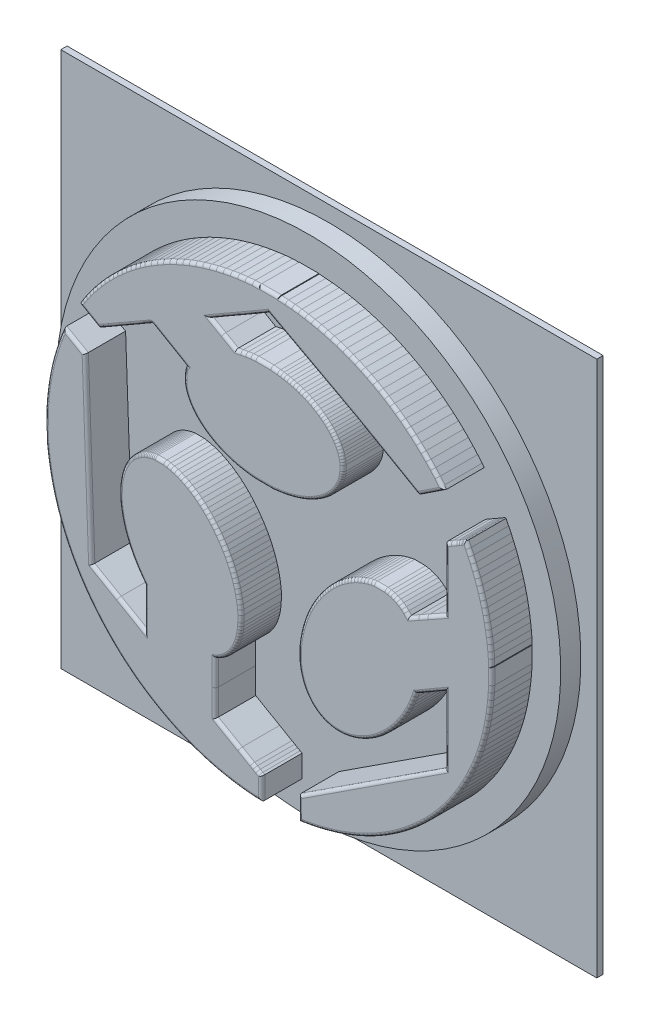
SolidWorks part; units mm, degrees
ref_plane "Спереди" through (0, 0, 0) normal (0, 0, 1) x (1, 0, 0)
ref_plane "Сверху" through (0, 0, 0) normal (0, 1, 0) x (1, 0, 0)
ref_plane "Справа" through (0, 0, 0) normal (1, 0, 0) x (0, 0, -1)
sketch "Эскиз3" plane through (0, 0, 0) normal (0, 0, 1) x (1, 0, 0)
  line L0 (2.1275, 44.2006) -> (2.0563, 44.2718)
  line L1 (2.0563, 44.2718) -> (-1.8596, 44.2718)
  line L2 (-1.8596, 44.2718) -> (-1.9308, 44.2006)
  line L3 (-1.9308, 44.2006) -> (-3.1411, 44.2006)
  line L4 (-3.1411, 44.2006) -> (-4.6219, 44.0589)
  line L5 (-4.6219, 44.0589) -> (-6.0838, 43.8731)
  line L6 (-6.0838, 43.8731) -> (-7.527, 43.6433)
  line L7 (-7.527, 43.6433) -> (-8.9515, 43.3697)
  line L8 (-8.9515, 43.3697) -> (-10.3575, 43.0524)
  line L9 (-10.3575, 43.0524) -> (-11.7451, 42.6915)
  line L10 (-11.7451, 42.6915) -> (-13.1145, 42.2873)
  line L11 (-13.1145, 42.2873) -> (-14.4658, 41.8398)
  line L12 (-14.4658, 41.8398) -> (-15.7992, 41.3493)
  line L13 (-15.7992, 41.3493) -> (-17.1147, 40.8158)
  line L14 (-17.1147, 40.8158) -> (-18.4125, 40.2395)
  line L15 (-18.4125, 40.2395) -> (-19.6927, 39.6206)
  line L16 (-19.6927, 39.6206) -> (-20.9555, 38.9592)
  line L17 (-20.9555, 38.9592) -> (-22.201, 38.2555)
  line L18 (-22.201, 38.2555) -> (-23.4294, 37.5096)
  line L19 (-23.4294, 37.5096) -> (-24.6407, 36.7216)
  line L20 (-24.6407, 36.7216) -> (-25.584, 36.0682)
  line L21 (-25.584, 36.0682) -> (-26.5149, 35.385)
  line L22 (-26.5149, 35.385) -> (-27.4331, 34.6721)
  line L23 (-27.4331, 34.6721) -> (-28.3385, 33.9297)
  line L24 (-28.3385, 33.9297) -> (-29.2308, 33.1578)
  line L25 (-29.2308, 33.1578) -> (-30.1099, 32.3566)
  line L26 (-30.1099, 32.3566) -> (-30.9755, 31.5263)
  line L27 (-30.9755, 31.5263) -> (-31.8274, 30.6668)
  line L28 (-31.8274, 30.6668) -> (-32.6621, 29.7768)
  line L29 (-32.6621, 29.7768) -> (-33.4569, 28.8777)
  line L30 (-33.4569, 28.8777) -> (-34.2198, 27.9653)
  line L31 (-34.2198, 27.9653) -> (-34.9586, 27.0358)
  line L32 (-34.9586, 27.0358) -> (-35.6246, 26.159)
  line L33 (-35.6246, 26.159) -> (-36.2577, 25.2685)
  line L34 (-36.2577, 25.2685) -> (-36.9008, 24.3223)
  line L35 (-36.9008, 24.3223) -> (-37.2006, 23.8353)
  line L36 (-37.2006, 23.8353) -> (-37.4701, 23.3218)
  line L37 (-37.4701, 23.3218) -> (-36.9719, 23.011)
  line L38 (-36.9719, 23.011) -> (-36.4982, 22.7359)
  line L39 (-36.4982, 22.7359) -> (-35.5449, 22.1859)
  line L40 (-35.5449, 22.1859) -> (-34.579, 21.6358)
  line L41 (-34.579, 21.6358) -> (-34.0955, 21.3511)
  line L42 (-34.0955, 21.3511) -> (-33.5906, 21.0158)
  line L43 (-33.5906, 21.0158) -> (-32.5015, 21.5978)
  line L44 (-32.5015, 21.5978) -> (-31.4203, 22.2157)
  line L45 (-31.4203, 22.2157) -> (-29.2647, 23.4714)
  line L46 (-29.2647, 23.4714) -> (-27.136, 24.6973)
  line L47 (-27.136, 24.6973) -> (-25.0078, 25.9187)
  line L48 (-25.0078, 25.9187) -> (-24.5071, 26.2214)
  line L49 (-24.5071, 26.2214) -> (-24.2561, 26.3658)
  line L50 (-24.2561, 26.3658) -> (-24.0067, 26.484)
  line L51 (-24.0067, 26.484) -> (-23.8674, 26.5559)
  line L52 (-23.8674, 26.5559) -> (-23.7263, 26.6515)
  line L53 (-23.7263, 26.6515) -> (-23.4407, 26.8593)
  line L54 (-23.4407, 26.8593) -> (-23.2971, 26.9444)
  line L55 (-23.2971, 26.9444) -> (-23.1535, 26.9989)
  line L56 (-23.1535, 26.9989) -> (-23.0104, 27.0091)
  line L57 (-23.0104, 27.0091) -> (-22.8682, 26.9615)
  line L58 (-22.8682, 26.9615) -> (-20.6586, 25.6844)
  line L59 (-20.6586, 25.6844) -> (-18.5187, 24.4469)
  line L60 (-18.5187, 24.4469) -> (-16.3858, 23.1997)
  line L61 (-16.3858, 23.1997) -> (-16.4317, 23.1505)
  line L62 (-16.4317, 23.1505) -> (-16.4612, 23.0925)
  line L63 (-16.4612, 23.0925) -> (-16.4888, 22.9607)
  line L64 (-16.4888, 22.9607) -> (-16.5042, 22.8258)
  line L65 (-16.5042, 22.8258) -> (-16.5431, 22.7093)
  line L66 (-16.5431, 22.7093) -> (-16.5868, 22.613)
  line L67 (-16.5868, 22.613) -> (-16.611, 22.5049)
  line L68 (-16.611, 22.5049) -> (-16.6285, 22.2702)
  line L69 (-16.6285, 22.2702) -> (-16.6509, 22.0375)
  line L70 (-16.6509, 22.0375) -> (-16.6811, 21.9321)
  line L71 (-16.6811, 21.9321) -> (-16.7332, 21.8394)
  line L72 (-16.7332, 21.8394) -> (-16.7399, 20.1358)
  line L73 (-16.7399, 20.1358) -> (-16.6698, 19.6483)
  line L74 (-16.6698, 19.6483) -> (-16.5605, 19.1654)
  line L75 (-16.5605, 19.1654) -> (-16.4145, 18.6884)
  line L76 (-16.4145, 18.6884) -> (-16.2339, 18.2184)
  line L77 (-16.2339, 18.2184) -> (-16.021, 17.7567)
  line L78 (-16.021, 17.7567) -> (-15.7781, 17.3044)
  line L79 (-15.7781, 17.3044) -> (-15.5075, 16.8628)
  line L80 (-15.5075, 16.8628) -> (-15.2113, 16.433)
  line L81 (-15.2113, 16.433) -> (-14.8919, 16.0164)
  line L82 (-14.8919, 16.0164) -> (-14.5516, 15.614)
  line L83 (-14.5516, 15.614) -> (-14.1925, 15.2271)
  line L84 (-14.1925, 15.2271) -> (-13.817, 14.8568)
  line L85 (-13.817, 14.8568) -> (-13.4272, 14.5045)
  line L86 (-13.4272, 14.5045) -> (-13.0256, 14.1713)
  line L87 (-13.0256, 14.1713) -> (-12.6143, 13.8584)
  line L88 (-12.6143, 13.8584) -> (-12.1956, 13.567)
  line L89 (-12.1956, 13.567) -> (-11.6655, 13.2283)
  line L90 (-11.6655, 13.2283) -> (-11.1267, 12.9109)
  line L91 (-11.1267, 12.9109) -> (-10.5794, 12.6145)
  line L92 (-10.5794, 12.6145) -> (-10.0235, 12.3386)
  line L93 (-10.0235, 12.3386) -> (-9.4592, 12.0828)
  line L94 (-9.4592, 12.0828) -> (-8.8865, 11.8467)
  line L95 (-8.8865, 11.8467) -> (-8.3055, 11.6299)
  line L96 (-8.3055, 11.6299) -> (-7.7162, 11.432)
  line L97 (-7.7162, 11.432) -> (-7.1187, 11.2526)
  line L98 (-7.1187, 11.2526) -> (-6.513, 11.0914)
  line L99 (-6.513, 11.0914) -> (-5.8993, 10.9478)
  line L100 (-5.8993, 10.9478) -> (-5.2776, 10.8215)
  line L101 (-5.2776, 10.8215) -> (-4.6479, 10.7121)
  line L102 (-4.6479, 10.7121) -> (-4.0103, 10.6191)
  line L103 (-4.0103, 10.6191) -> (-2.7117, 10.4811)
  line L104 (-2.7117, 10.4811) -> (0.8459, 10.4529)
  line L105 (0.8459, 10.4529) -> (2.1472, 10.6082)
  line L106 (2.1472, 10.6082) -> (3.4187, 10.8214)
  line L107 (3.4187, 10.8214) -> (4.0431, 10.9516)
  line L108 (4.0431, 10.9516) -> (4.6599, 11.0984)
  line L109 (4.6599, 11.0984) -> (5.2691, 11.2625)
  line L110 (5.2691, 11.2625) -> (5.8706, 11.4448)
  line L111 (5.8706, 11.4448) -> (6.4643, 11.6458)
  line L112 (6.4643, 11.6458) -> (7.0501, 11.8663)
  line L113 (7.0501, 11.8663) -> (7.6281, 12.1071)
  line L114 (7.6281, 12.1071) -> (8.1982, 12.3688)
  line L115 (8.1982, 12.3688) -> (8.7603, 12.6522)
  line L116 (8.7603, 12.6522) -> (9.3144, 12.958)
  line L117 (9.3144, 12.958) -> (9.8604, 13.2869)
  line L118 (9.8604, 13.2869) -> (10.3982, 13.6396)
  line L119 (10.3982, 13.6396) -> (10.8274, 13.9463)
  line L120 (10.8274, 13.9463) -> (11.246, 14.2728)
  line L121 (11.246, 14.2728) -> (11.6518, 14.6181)
  line L122 (11.6518, 14.6181) -> (12.0428, 14.9815)
  line L123 (12.0428, 14.9815) -> (12.417, 15.3619)
  line L124 (12.417, 15.3619) -> (12.7722, 15.7586)
  line L125 (12.7722, 15.7586) -> (13.1065, 16.1706)
  line L126 (13.1065, 16.1706) -> (13.4177, 16.597)
  line L127 (13.4177, 16.597) -> (13.7039, 17.0371)
  line L128 (13.7039, 17.0371) -> (13.9628, 17.4898)
  line L129 (13.9628, 17.4898) -> (14.1926, 17.9543)
  line L130 (14.1926, 17.9543) -> (14.391, 18.4297)
  line L131 (14.391, 18.4297) -> (14.5561, 18.9152)
  line L132 (14.5561, 18.9152) -> (14.6858, 19.4099)
  line L133 (14.6858, 19.4099) -> (14.778, 19.9128)
  line L134 (14.778, 19.9128) -> (14.8307, 20.4231)
  line L135 (14.8307, 20.4231) -> (14.8719, 21.5597)
  line L136 (14.8719, 21.5597) -> (14.8162, 22.063)
  line L137 (14.8162, 22.063) -> (14.7203, 22.5604)
  line L138 (14.7203, 22.5604) -> (14.5865, 23.051)
  line L139 (14.5865, 23.051) -> (14.417, 23.5336)
  line L140 (14.417, 23.5336) -> (14.2138, 24.0073)
  line L141 (14.2138, 24.0073) -> (13.9793, 24.471)
  line L142 (13.9793, 24.471) -> (13.7155, 24.9237)
  line L143 (13.7155, 24.9237) -> (13.4247, 25.3642)
  line L144 (13.4247, 25.3642) -> (13.1092, 25.7916)
  line L145 (13.1092, 25.7916) -> (12.771, 26.2048)
  line L146 (12.771, 26.2048) -> (12.4123, 26.6028)
  line L147 (12.4123, 26.6028) -> (12.0354, 26.9845)
  line L148 (12.0354, 26.9845) -> (11.6424, 27.3488)
  line L149 (11.6424, 27.3488) -> (11.2356, 27.6948)
  line L150 (11.2356, 27.6948) -> (10.8171, 28.0213)
  line L151 (10.8171, 28.0213) -> (10.3891, 28.3274)
  line L152 (10.3891, 28.3274) -> (9.8373, 28.689)
  line L153 (9.8373, 28.689) -> (9.2769, 29.0256)
  line L154 (9.2769, 29.0256) -> (8.7081, 29.3378)
  line L155 (8.7081, 29.3378) -> (8.1308, 29.6264)
  line L156 (8.1308, 29.6264) -> (7.545, 29.8921)
  line L157 (7.545, 29.8921) -> (6.9509, 30.1356)
  line L158 (6.9509, 30.1356) -> (6.3485, 30.3576)
  line L159 (6.3485, 30.3576) -> (5.7378, 30.5588)
  line L160 (5.7378, 30.5588) -> (5.1188, 30.74)
  line L161 (5.1188, 30.74) -> (4.4917, 30.9018)
  line L162 (4.4917, 30.9018) -> (3.8564, 31.0451)
  line L163 (3.8564, 31.0451) -> (3.2131, 31.1704)
  line L164 (3.2131, 31.1704) -> (2.5616, 31.2786)
  line L165 (2.5616, 31.2786) -> (1.9022, 31.3703)
  line L166 (1.9022, 31.3703) -> (0.5595, 31.5073)
  line L167 (0.5595, 31.5073) -> (-2.4292, 31.5274)
  line L168 (-2.4292, 31.5274) -> (-3.4693, 31.4304)
  line L169 (-3.4693, 31.4304) -> (-4.492, 31.2864)
  line L170 (-4.492, 31.2864) -> (-5.4976, 31.103)
  line L171 (-5.4976, 31.103) -> (-6.4867, 30.8878)
  line L172 (-6.4867, 30.8878) -> (-8.9777, 32.3147)
  line L173 (-8.9777, 32.3147) -> (-11.4696, 33.7318)
  line L174 (-11.4696, 33.7318) -> (-8.601, 35.4001)
  line L175 (-8.601, 35.4001) -> (-5.7396, 37.0419)
  line L176 (-5.7396, 37.0419) -> (-2.8709, 38.6969)
  line L177 (-2.8709, 38.6969) -> (0.0195, 40.4045)
  line L178 (0.0195, 40.4045) -> (17.4904, 31.0451)
  line L179 (17.4904, 31.0451) -> (29.7987, 24.0073)
  line L180 (6.0294, -39.2566) -> (6.0294, -43.883)
  line L181 (-2.1531, -39.2566) -> (-1.6503, -39.5238)
  line L182 (-1.2539, -39.7292) -> (-1.29, -44.1558)
  line L189 (34.8335, 27.3338) -> (34.4085, 27.8744)
  line L190 (34.4085, 27.8744) -> (33.5296, 28.9242)
  line L191 (33.5296, 28.9242) -> (32.6229, 29.9426)
  line L192 (32.6229, 29.9426) -> (31.6891, 30.9292)
  line L193 (31.6891, 30.9292) -> (30.7292, 31.8835)
  line L194 (30.7292, 31.8835) -> (29.744, 32.8053)
  line L195 (29.744, 32.8053) -> (28.7345, 33.6942)
  line L196 (28.7345, 33.6942) -> (27.7014, 34.5497)
  line L197 (27.7014, 34.5497) -> (26.6457, 35.3717)
  line L198 (26.6457, 35.3717) -> (25.5682, 36.1596)
  line L199 (25.5682, 36.1596) -> (24.4699, 36.9133)
  line L200 (24.4699, 36.9133) -> (23.3516, 37.6322)
  line L201 (23.3516, 37.6322) -> (22.2141, 38.316)
  line L202 (22.2141, 38.316) -> (21.0583, 38.9645)
  line L203 (21.0583, 38.9645) -> (19.8852, 39.5772)
  line L204 (19.8852, 39.5772) -> (18.6956, 40.1538)
  line L205 (18.6956, 40.1538) -> (17.4904, 40.6939)
  line L206 (17.4904, 40.6939) -> (16.2704, 41.1971)
  line L207 (16.2704, 41.1971) -> (15.0365, 41.6632)
  line L208 (15.0365, 41.6632) -> (13.7896, 42.0918)
  line L209 (13.7896, 42.0918) -> (12.5307, 42.4824)
  line L210 (12.5307, 42.4824) -> (11.2604, 42.8348)
  line L211 (11.2604, 42.8348) -> (9.9798, 43.1486)
  line L212 (9.9798, 43.1486) -> (8.6897, 43.4234)
  line L213 (8.6897, 43.4234) -> (7.391, 43.6589)
  line L214 (7.391, 43.6589) -> (6.0845, 43.8547)
  line L215 (6.0845, 43.8547) -> (4.7712, 44.0105)
  line L216 (4.7712, 44.0105) -> (3.4519, 44.1259)
  line L217 (3.4519, 44.1259) -> (2.1275, 44.2006)
  line L218 (34.8335, 27.3338) -> (29.7987, 24.0073)
  line L227 (-40.5204, 17.6546) -> (-40.7542, 17.1411)
  line L228 (-40.7542, 17.1411) -> (-41.1098, 16.2822)
  line L229 (-41.1098, 16.2822) -> (-41.4417, 15.4111)
  line L230 (-41.4417, 15.4111) -> (-41.7593, 14.5212)
  line L231 (-41.7593, 14.5212) -> (-42.2603, 12.9982)
  line L232 (-42.2603, 12.9982) -> (-42.7027, 11.4772)
  line L233 (-42.7027, 11.4772) -> (-43.0877, 9.9508)
  line L234 (-43.0877, 9.9508) -> (-43.4164, 8.4117)
  line L235 (-43.4164, 8.4117) -> (-43.6902, 6.8524)
  line L236 (-43.6902, 6.8524) -> (-43.9103, 5.2654)
  line L237 (-43.9103, 5.2654) -> (-44.0779, 3.6434)
  line L238 (-44.0779, 3.6434) -> (-44.1942, 1.9788)
  line L239 (-44.1942, 1.9788) -> (-44.2222, -1.8643)
  line L240 (-44.2222, -1.8643) -> (-44.151, -1.9355)
  line L241 (-44.151, -1.9355) -> (-44.151, -3.2171)
  line L242 (-44.151, -3.2171) -> (-44.0542, -4.2267)
  line L243 (-44.0542, -4.2267) -> (-43.9378, -5.2289)
  line L244 (-43.9378, -5.2289) -> (-43.8018, -6.2237)
  line L245 (-43.8018, -6.2237) -> (-43.6461, -7.2109)
  line L246 (-43.6461, -7.2109) -> (-43.4707, -8.1905)
  line L247 (-43.4707, -8.1905) -> (-43.2755, -9.1624)
  line L248 (-43.2755, -9.1624) -> (-43.0605, -10.1265)
  line L249 (-43.0605, -10.1265) -> (-42.8256, -11.0828)
  line L250 (-42.8256, -11.0828) -> (-42.5707, -12.0312)
  line L251 (-42.5707, -12.0312) -> (-42.2957, -12.9715)
  line L252 (-42.2957, -12.9715) -> (-42.0007, -13.9038)
  line L253 (-42.0007, -13.9038) -> (-41.6855, -14.828)
  line L254 (-41.6855, -14.828) -> (-41.3501, -15.7439)
  line L255 (-41.3501, -15.7439) -> (-40.9944, -16.6515)
  line L256 (-40.9944, -16.6515) -> (-40.6184, -17.5508)
  line L257 (-40.6184, -17.5508) -> (-40.222, -18.4416)
  line L258 (-40.222, -18.4416) -> (-39.8051, -19.3239)
  line L259 (-39.8051, -19.3239) -> (-39.3676, -20.1977)
  line L260 (-39.3676, -20.1977) -> (-38.9096, -21.0627)
  line L261 (-38.9096, -21.0627) -> (-38.4309, -21.919)
  line L262 (-38.4309, -21.919) -> (-37.9316, -22.7665)
  line L263 (-37.9316, -22.7665) -> (-37.4114, -23.6051)
  line L264 (-37.4114, -23.6051) -> (-36.8704, -24.4347)
  line L265 (-36.8704, -24.4347) -> (-36.3085, -25.2553)
  line L266 (-36.3085, -25.2553) -> (-35.7257, -26.0668)
  line L267 (-35.7257, -26.0668) -> (-35.1218, -26.8691)
  line L268 (-35.1218, -26.8691) -> (-34.4968, -27.6621)
  line L269 (-34.4968, -27.6621) -> (-33.8507, -28.4457)
  line L270 (-33.8507, -28.4457) -> (-33.1834, -29.22)
  line L271 (-33.1834, -29.22) -> (-32.4948, -29.9848)
  line L272 (-32.4948, -29.9848) -> (-31.7849, -30.74)
  line L273 (-31.7849, -30.74) -> (-31.0536, -31.4856)
  line L274 (-31.0536, -31.4856) -> (-29.8504, -32.6407)
  line L275 (-29.8504, -32.6407) -> (-28.6209, -33.7323)
  line L276 (-28.6209, -33.7323) -> (-27.3656, -34.7631)
  line L277 (-27.3656, -34.7631) -> (-26.0853, -35.7357)
  line L278 (-26.0853, -35.7357) -> (-24.7804, -36.6527)
  line L279 (-24.7804, -36.6527) -> (-23.4517, -37.5169)
  line L280 (-23.4517, -37.5169) -> (-22.0997, -38.3308)
  line L281 (-22.0997, -38.3308) -> (-20.7251, -39.0972)
  line L282 (-20.7251, -39.0972) -> (-19.6893, -39.6352)
  line L283 (-19.6893, -39.6352) -> (-18.6417, -40.1442)
  line L284 (-18.6417, -40.1442) -> (-17.5824, -40.6241)
  line L285 (-17.5824, -40.6241) -> (-16.5115, -41.0749)
  line L286 (-16.5115, -41.0749) -> (-15.429, -41.4965)
  line L287 (-15.429, -41.4965) -> (-14.3351, -41.889)
  line L288 (-14.3351, -41.889) -> (-13.2298, -42.2521)
  line L289 (-13.2298, -42.2521) -> (-12.1132, -42.586)
  line L290 (-12.1132, -42.586) -> (-10.9853, -42.8904)
  line L291 (-10.9853, -42.8904) -> (-9.8463, -43.1654)
  line L292 (-9.8463, -43.1654) -> (-8.6963, -43.4109)
  line L293 (-8.6963, -43.4109) -> (-7.5352, -43.6269)
  line L294 (-7.5352, -43.6269) -> (-6.3633, -43.8133)
  line L295 (-6.3633, -43.8133) -> (-5.1805, -43.9701)
  line L296 (-5.1805, -43.9701) -> (-3.9871, -44.0971)
  line L297 (-3.9871, -44.0971) -> (-2.7829, -44.1944)
  line L298 (-2.7829, -44.1944) -> (-1.3612, -44.227)
  line L299 (-1.3612, -44.227) -> (-1.29, -44.1558)
  line L308 (-1.6503, -39.5238) -> (-1.2539, -39.7292)
  line L310 (-2.1531, -39.2566) -> (-2.7069, -38.9198)
  line L311 (-2.7069, -38.9198) -> (-3.2796, -38.5954)
  line L312 (-3.2796, -38.5954) -> (-5.7111, -37.1903)
  line L313 (-5.7111, -37.1903) -> (-10.462, -34.4514)
  line L314 (-10.462, -34.4514) -> (-10.4745, -29.311)
  line L315 (-10.4745, -29.311) -> (-10.4745, -24.1492)
  line L316 (-10.4745, -24.1492) -> (-9.8512, -23.8656)
  line L317 (-9.8512, -23.8656) -> (-9.2715, -23.532)
  line L318 (-9.2715, -23.532) -> (-8.7348, -23.1522)
  line L319 (-8.7348, -23.1522) -> (-8.2406, -22.7297)
  line L320 (-8.2406, -22.7297) -> (-7.7882, -22.2684)
  line L321 (-7.7882, -22.2684) -> (-7.377, -21.7718)
  line L322 (-7.377, -21.7718) -> (-7.0064, -21.2437)
  line L323 (-7.0064, -21.2437) -> (-6.6758, -20.6877)
  line L324 (-6.6758, -20.6877) -> (-6.3846, -20.1074)
  line L325 (-6.3846, -20.1074) -> (-6.1321, -19.5066)
  line L326 (-6.1321, -19.5066) -> (-5.9179, -18.8889)
  line L327 (-5.9179, -18.8889) -> (-5.7412, -18.2579)
  line L328 (-5.7412, -18.2579) -> (-5.6014, -17.6175)
  line L329 (-5.6014, -17.6175) -> (-5.498, -16.9711)
  line L330 (-5.498, -16.9711) -> (-5.4304, -16.3226)
  line L331 (-5.4304, -16.3226) -> (-5.3978, -15.6755)
  line L332 (-5.3978, -15.6755) -> (-5.3483, -14.3239)
  line L333 (-5.3483, -14.3239) -> (-5.4344, -13.4452)
  line L334 (-5.4344, -13.4452) -> (-5.5508, -12.5818)
  line L335 (-5.5508, -12.5818) -> (-5.6974, -11.7335)
  line L336 (-5.6974, -11.7335) -> (-5.8742, -10.8997)
  line L337 (-5.8742, -10.8997) -> (-6.0811, -10.0799)
  line L338 (-6.0811, -10.0799) -> (-6.3181, -9.2738)
  line L339 (-6.3181, -9.2738) -> (-6.5851, -8.4809)
  line L340 (-6.5851, -8.4809) -> (-6.8821, -7.7008)
  line L341 (-6.8821, -7.7008) -> (-7.2091, -6.933)
  line L342 (-7.2091, -6.933) -> (-7.566, -6.177)
  line L343 (-7.566, -6.177) -> (-7.9528, -5.4324)
  line L344 (-7.9528, -5.4324) -> (-8.3694, -4.6988)
  line L345 (-8.3694, -4.6988) -> (-8.8158, -3.9758)
  line L346 (-8.8158, -3.9758) -> (-9.2919, -3.2628)
  line L347 (-9.2919, -3.2628) -> (-9.7978, -2.5594)
  line L348 (-9.7978, -2.5594) -> (-10.3333, -1.8652)
  line L349 (-10.3333, -1.8652) -> (-10.8455, -1.2458)
  line L350 (-10.8455, -1.2458) -> (-11.378, -0.6468)
  line L351 (-11.378, -0.6468) -> (-11.9302, -0.0701)
  line L352 (-11.9302, -0.0701) -> (-12.5015, 0.4826)
  line L353 (-12.5015, 0.4826) -> (-13.0915, 1.0095)
  line L354 (-13.0915, 1.0095) -> (-13.6995, 1.509)
  line L355 (-13.6995, 1.509) -> (-14.3251, 1.9792)
  line L356 (-14.3251, 1.9792) -> (-14.9677, 2.4184)
  line L357 (-14.9677, 2.4184) -> (-15.6268, 2.8249)
  line L358 (-15.6268, 2.8249) -> (-16.3019, 3.1969)
  line L359 (-16.3019, 3.1969) -> (-16.9923, 3.5326)
  line L360 (-16.9923, 3.5326) -> (-17.6976, 3.8304)
  line L361 (-17.6976, 3.8304) -> (-18.4173, 4.0884)
  line L362 (-18.4173, 4.0884) -> (-19.1507, 4.305)
  line L363 (-19.1507, 4.305) -> (-19.8974, 4.4783)
  line L364 (-19.8974, 4.4783) -> (-20.6569, 4.6066)
  line L365 (-20.6569, 4.6066) -> (-22.3645, 4.6147)
  line L366 (-22.3645, 4.6147) -> (-22.717, 4.5738)
  line L367 (-22.717, 4.5738) -> (-23.0668, 4.5156)
  line L368 (-23.0668, 4.5156) -> (-23.4133, 4.4402)
  line L369 (-23.4133, 4.4402) -> (-23.7558, 4.3478)
  line L370 (-23.7558, 4.3478) -> (-24.0937, 4.2385)
  line L371 (-24.0937, 4.2385) -> (-24.4265, 4.1125)
  line L372 (-24.4265, 4.1125) -> (-24.7536, 3.97)
  line L373 (-24.7536, 3.97) -> (-25.0742, 3.8111)
  line L374 (-25.0742, 3.8111) -> (-25.3878, 3.636)
  line L375 (-25.3878, 3.636) -> (-25.6939, 3.4449)
  line L376 (-25.6939, 3.4449) -> (-25.9917, 3.2379)
  line L377 (-25.9917, 3.2379) -> (-26.2808, 3.0152)
  line L378 (-26.2808, 3.0152) -> (-26.5604, 2.777)
  line L379 (-26.5604, 2.777) -> (-26.8299, 2.5233)
  line L380 (-26.8299, 2.5233) -> (-27.0889, 2.2545)
  line L381 (-27.0889, 2.2545) -> (-27.3365, 1.9705)
  line L382 (-27.3365, 1.9705) -> (-27.5906, 1.6498)
  line L383 (-27.5906, 1.6498) -> (-27.825, 1.3243)
  line L384 (-27.825, 1.3243) -> (-28.0405, 0.994)
  line L385 (-28.0405, 0.994) -> (-28.2381, 0.6586)
  line L386 (-28.2381, 0.6586) -> (-28.5831, -0.0273)
  line L387 (-28.5831, -0.0273) -> (-28.8669, -0.7344)
  line L388 (-28.8669, -0.7344) -> (-29.0966, -1.4633)
  line L389 (-29.0966, -1.4633) -> (-29.2795, -2.215)
  line L390 (-29.2795, -2.215) -> (-29.4225, -2.99)
  line L391 (-29.4225, -2.99) -> (-29.5328, -3.7894)
  line L392 (-29.5328, -3.7894) -> (-29.5555, -6.065)
  line L393 (-29.5555, -6.065) -> (-29.4705, -6.9221)
  line L394 (-29.4705, -6.9221) -> (-29.352, -7.7671)
  line L395 (-29.352, -7.7671) -> (-29.2006, -8.6002)
  line L396 (-29.2006, -8.6002) -> (-29.0168, -9.4213)
  line L397 (-29.0168, -9.4213) -> (-28.8012, -10.2307)
  line L398 (-28.8012, -10.2307) -> (-28.5545, -11.0283)
  line L399 (-28.5545, -11.0283) -> (-28.2771, -11.8143)
  line L400 (-28.2771, -11.8143) -> (-27.9696, -12.5888)
  line L401 (-27.9696, -12.5888) -> (-27.6328, -13.3519)
  line L402 (-27.6328, -13.3519) -> (-27.267, -14.1036)
  line L403 (-27.267, -14.1036) -> (-26.873, -14.8441)
  line L404 (-26.873, -14.8441) -> (-26.4513, -15.5734)
  line L405 (-26.4513, -15.5734) -> (-26.0025, -16.2917)
  line L406 (-26.0025, -16.2917) -> (-25.5271, -16.999)
  line L407 (-25.5271, -16.999) -> (-25.0258, -17.6955)
  line L408 (-25.0258, -17.6955) -> (-24.4992, -18.3812)
  line L409 (-24.4992, -18.3812) -> (-24.5005, -22.3693)
  line L410 (-24.5005, -22.3693) -> (-24.5005, -26.3563)
  line L411 (-24.5005, -26.3563) -> (-29.7315, -23.3256)
  line L412 (-29.7315, -23.3256) -> (-34.9662, -20.304)
  line L413 (-34.9662, -20.304) -> (-36.2577, 15.2271)
  line L416 (39.1503, 20.7765) -> (39.0292, 20.7829)
  line L417 (39.0292, 20.7829) -> (38.9059, 20.7589)
  line L418 (38.9059, 20.7589) -> (38.781, 20.711)
  line L419 (38.781, 20.711) -> (38.6553, 20.6459)
  line L420 (38.6553, 20.6459) -> (38.404, 20.4896)
  line L421 (38.404, 20.4896) -> (38.1573, 20.342)
  line L422 (38.1573, 20.342) -> (37.6608, 20.0606)
  line L423 (37.6608, 20.0606) -> (37.162, 19.7703)
  line L424 (37.162, 19.7703) -> (36.1247, 19.1753)
  line L425 (36.1247, 19.1753) -> (35.0884, 18.5758)
  line L426 (35.0884, 18.5758) -> (35.092, 12.4108)
  line L427 (35.092, 12.4108) -> (35.092, 6.2522)
  line L428 (35.092, 6.2522) -> (31.4619, 4.217)
  line L429 (31.4619, 4.217) -> (29.6469, 3.1957)
  line L430 (29.6469, 3.1957) -> (27.8179, 2.1836)
  line L431 (27.8179, 2.1836) -> (27.3194, 2.7105)
  line L432 (27.3194, 2.7105) -> (26.8001, 3.1673)
  line L433 (26.8001, 3.1673) -> (26.2591, 3.5579)
  line L434 (26.2591, 3.5579) -> (25.6956, 3.8865)
  line L435 (25.6956, 3.8865) -> (25.1086, 4.1572)
  line L436 (25.1086, 4.1572) -> (24.4974, 4.3739)
  line L437 (24.4974, 4.3739) -> (23.861, 4.5409)
  line L438 (23.861, 4.5409) -> (23.1985, 4.6623)
  line L439 (23.1985, 4.6623) -> (21.0661, 4.6859)
  line L440 (21.0661, 4.6859) -> (20.3449, 4.5589)
  line L441 (20.3449, 4.5589) -> (19.6323, 4.3878)
  line L442 (19.6323, 4.3878) -> (18.9293, 4.1743)
  line L443 (18.9293, 4.1743) -> (18.2367, 3.9203)
  line L444 (18.2367, 3.9203) -> (17.5554, 3.6278)
  line L445 (17.5554, 3.6278) -> (16.8862, 3.2985)
  line L446 (16.8862, 3.2985) -> (16.23, 2.9344)
  line L447 (16.23, 2.9344) -> (15.5877, 2.5374)
  line L448 (15.5877, 2.5374) -> (14.9601, 2.1092)
  line L449 (14.9601, 2.1092) -> (14.3481, 1.6519)
  line L450 (14.3481, 1.6519) -> (13.7526, 1.1673)
  line L451 (13.7526, 1.1673) -> (13.1745, 0.6571)
  line L452 (13.1745, 0.6571) -> (12.6145, 0.1235)
  line L453 (12.6145, 0.1235) -> (12.0737, -0.4319)
  line L454 (12.0737, -0.4319) -> (11.5528, -1.0071)
  line L455 (11.5528, -1.0071) -> (11.0527, -1.6003)
  line L456 (11.0527, -1.6003) -> (10.5251, -2.2705)
  line L457 (10.5251, -2.2705) -> (10.0257, -2.9496)
  line L458 (10.0257, -2.9496) -> (9.5547, -3.638)
  line L459 (9.5547, -3.638) -> (9.1118, -4.3361)
  line L460 (9.1118, -4.3361) -> (8.697, -5.0443)
  line L461 (8.697, -5.0443) -> (8.3104, -5.763)
  line L462 (8.3104, -5.763) -> (7.9518, -6.4926)
  line L463 (7.9518, -6.4926) -> (7.6212, -7.2334)
  line L464 (7.6212, -7.2334) -> (7.3185, -7.9858)
  line L465 (7.3185, -7.9858) -> (7.0437, -8.7504)
  line L466 (7.0437, -8.7504) -> (6.7968, -9.5273)
  line L467 (6.7968, -9.5273) -> (6.5777, -10.3171)
  line L468 (6.5777, -10.3171) -> (6.3862, -11.1202)
  line L469 (6.3862, -11.1202) -> (6.2225, -11.9368)
  line L470 (6.2225, -11.9368) -> (6.0865, -12.7675)
  line L471 (6.0865, -12.7675) -> (5.978, -13.6126)
  line L472 (5.978, -13.6126) -> (5.9722, -16.1751)
  line L473 (5.9722, -16.1751) -> (6.0277, -16.7276)
  line L474 (6.0277, -16.7276) -> (6.1105, -17.2835)
  line L475 (6.1105, -17.2835) -> (6.2211, -17.8397)
  line L476 (6.2211, -17.8397) -> (6.3599, -18.3933)
  line L477 (6.3599, -18.3933) -> (6.5274, -18.9415)
  line L478 (6.5274, -18.9415) -> (6.7242, -19.4812)
  line L479 (6.7242, -19.4812) -> (6.9505, -20.0096)
  line L480 (6.9505, -20.0096) -> (7.2069, -20.5237)
  line L481 (7.2069, -20.5237) -> (7.4939, -21.0206)
  line L482 (7.4939, -21.0206) -> (7.8119, -21.4974)
  line L483 (7.8119, -21.4974) -> (8.1615, -21.9512)
  line L484 (8.1615, -21.9512) -> (8.5429, -22.3789)
  line L485 (8.5429, -22.3789) -> (8.9568, -22.7778)
  line L486 (8.9568, -22.7778) -> (9.4035, -23.1449)
  line L487 (9.4035, -23.1449) -> (9.8836, -23.4772)
  line L488 (9.8836, -23.4772) -> (10.3975, -23.7718)
  line L489 (10.3975, -23.7718) -> (11.0109, -24.0556)
  line L490 (11.0109, -24.0556) -> (11.633, -24.2791)
  line L491 (11.633, -24.2791) -> (12.2623, -24.4449)
  line L492 (12.2623, -24.4449) -> (12.8968, -24.5558)
  line L493 (12.8968, -24.5558) -> (13.535, -24.6146)
  line L494 (13.535, -24.6146) -> (14.1749, -24.6238)
  line L495 (14.1749, -24.6238) -> (14.8148, -24.5862)
  line L496 (14.8148, -24.5862) -> (15.4531, -24.5046)
  line L497 (15.4531, -24.5046) -> (16.0879, -24.3816)
  line L498 (16.0879, -24.3816) -> (16.7175, -24.2199)
  line L499 (16.7175, -24.2199) -> (17.3401, -24.0223)
  line L500 (17.3401, -24.0223) -> (17.954, -23.7915)
  line L501 (17.954, -23.7915) -> (18.5574, -23.5301)
  line L502 (18.5574, -23.5301) -> (19.1486, -23.2409)
  line L503 (19.1486, -23.2409) -> (19.7258, -22.9266)
  line L504 (19.7258, -22.9266) -> (20.2873, -22.5899)
  line L505 (20.2873, -22.5899) -> (21.0995, -22.0471)
  line L506 (21.0995, -22.0471) -> (21.8856, -21.4561)
  line L507 (21.8856, -21.4561) -> (22.6445, -20.8207)
  line L508 (22.6445, -20.8207) -> (23.3745, -20.1447)
  line L509 (23.3745, -20.1447) -> (24.0745, -19.4319)
  line L510 (24.0745, -19.4319) -> (24.7429, -18.6861)
  line L511 (24.7429, -18.6861) -> (25.3784, -17.9111)
  line L512 (25.3784, -17.9111) -> (25.9796, -17.1108)
  line L513 (25.9796, -17.1108) -> (26.5452, -16.2888)
  line L514 (26.5452, -16.2888) -> (27.0737, -15.449)
  line L515 (27.0737, -15.449) -> (27.5638, -14.5953)
  line L516 (27.5638, -14.5953) -> (28.0141, -13.7313)
  line L517 (28.0141, -13.7313) -> (28.4231, -12.861)
  line L518 (28.4231, -12.861) -> (28.7896, -11.988)
  line L519 (28.7896, -11.988) -> (29.1121, -11.1163)
  line L520 (29.1121, -11.1163) -> (29.3893, -10.2496)
  line L521 (29.3893, -10.2496) -> (29.7987, -10.0545)
  line L522 (29.7987, -10.0545) -> (30.1391, -9.8614)
  line L523 (30.1391, -9.8614) -> (30.8093, -9.4627)
  line L524 (30.8093, -9.4627) -> (31.5361, -9.0472)
  line L525 (31.5361, -9.0472) -> (32.2467, -8.6327)
  line L526 (32.2467, -8.6327) -> (33.6692, -7.8094)
  line L527 (33.6692, -7.8094) -> (35.0944, -6.9948)
  line L528 (35.0944, -6.9948) -> (35.092, -13.6475)
  line L529 (35.092, -13.6475) -> (35.092, -20.3045)
  line L530 (35.092, -20.3045) -> (6.0294, -39.2566)
  line L537 (6.0294, -43.883) -> (6.9235, -43.7491)
  line L538 (6.9235, -43.7491) -> (7.906, -43.5813)
  line L539 (7.906, -43.5813) -> (8.8803, -43.3939)
  line L540 (8.8803, -43.3939) -> (9.8463, -43.187)
  line L541 (9.8463, -43.187) -> (10.8039, -42.9604)
  line L542 (10.8039, -42.9604) -> (11.7532, -42.714)
  line L543 (11.7532, -42.714) -> (12.6941, -42.4478)
  line L544 (12.6941, -42.4478) -> (13.6266, -42.1618)
  line L545 (13.6266, -42.1618) -> (14.5508, -41.8557)
  line L546 (14.5508, -41.8557) -> (15.4665, -41.5295)
  line L547 (15.4665, -41.5295) -> (16.3738, -41.1832)
  line L548 (16.3738, -41.1832) -> (17.2727, -40.8166)
  line L549 (17.2727, -40.8166) -> (18.1631, -40.4297)
  line L550 (18.1631, -40.4297) -> (19.0451, -40.0225)
  line L551 (19.0451, -40.0225) -> (19.9185, -39.5947)
  line L552 (19.9185, -39.5947) -> (20.7835, -39.1464)
  line L553 (20.7835, -39.1464) -> (21.6399, -38.6774)
  line L554 (21.6399, -38.6774) -> (22.4878, -38.1878)
  line L555 (22.4878, -38.1878) -> (23.3272, -37.6773)
  line L556 (23.3272, -37.6773) -> (24.1579, -37.1459)
  line L557 (24.1579, -37.1459) -> (24.9801, -36.5936)
  line L558 (24.9801, -36.5936) -> (25.7937, -36.0202)
  line L559 (25.7937, -36.0202) -> (26.5987, -35.4257)
  line L560 (26.5987, -35.4257) -> (27.395, -34.81)
  line L561 (27.395, -34.81) -> (28.1827, -34.173)
  line L562 (28.1827, -34.173) -> (28.9617, -33.5147)
  line L563 (28.9617, -33.5147) -> (29.732, -32.8349)
  line L564 (29.732, -32.8349) -> (30.4936, -32.1335)
  line L565 (30.4936, -32.1335) -> (31.2466, -31.4106)
  line L566 (31.2466, -31.4106) -> (31.8536, -30.8032)
  line L567 (31.8536, -30.8032) -> (32.4442, -30.1877)
  line L568 (32.4442, -30.1877) -> (33.0187, -29.5644)
  line L569 (33.0187, -29.5644) -> (33.5772, -28.9334)
  line L570 (33.5772, -28.9334) -> (34.6472, -27.6495)
  line L571 (34.6472, -27.6495) -> (35.6563, -26.3382)
  line L572 (35.6563, -26.3382) -> (36.6063, -25.0014)
  line L573 (36.6063, -25.0014) -> (37.4991, -23.6411)
  line L574 (37.4991, -23.6411) -> (38.3367, -22.2594)
  line L575 (38.3367, -22.2594) -> (39.1208, -20.8583)
  line L576 (39.1208, -20.8583) -> (39.6933, -19.7569)
  line L577 (39.6933, -19.7569) -> (40.2338, -18.642)
  line L578 (40.2338, -18.642) -> (40.7421, -17.5135)
  line L579 (40.7421, -17.5135) -> (41.2179, -16.3713)
  line L580 (41.2179, -16.3713) -> (41.6611, -15.2154)
  line L581 (41.6611, -15.2154) -> (42.0714, -14.0457)
  line L582 (42.0714, -14.0457) -> (42.4487, -12.8622)
  line L583 (42.4487, -12.8622) -> (42.7926, -11.6647)
  line L584 (42.7926, -11.6647) -> (43.1031, -10.4533)
  line L585 (43.1031, -10.4533) -> (43.3799, -9.2279)
  line L586 (43.3799, -9.2279) -> (43.6227, -7.9885)
  line L587 (43.6227, -7.9885) -> (43.8314, -6.7349)
  line L588 (43.8314, -6.7349) -> (44.0058, -5.4672)
  line L589 (44.0058, -5.4672) -> (44.1456, -4.1852)
  line L590 (44.1456, -4.1852) -> (44.2506, -2.889)
  line L591 (44.2506, -2.889) -> (44.3207, -1.5785)
  line L592 (44.3207, -1.5785) -> (44.3477, 1.6244)
  line L593 (44.3477, 1.6244) -> (44.2765, 1.6956)
  line L594 (44.2765, 1.6956) -> (44.2765, 2.9771)
  line L595 (44.2765, 2.9771) -> (44.1706, 4.1828)
  line L596 (44.1706, 4.1828) -> (44.0351, 5.3746)
  line L597 (44.0351, 5.3746) -> (43.8703, 6.5528)
  line L598 (43.8703, 6.5528) -> (43.6764, 7.7176)
  line L599 (43.6764, 7.7176) -> (43.4535, 8.8695)
  line L600 (43.4535, 8.8695) -> (43.2019, 10.0088)
  line L601 (43.2019, 10.0088) -> (42.9217, 11.1357)
  line L602 (42.9217, 11.1357) -> (42.6133, 12.2506)
  line L603 (42.6133, 12.2506) -> (42.2767, 13.3538)
  line L604 (42.2767, 13.3538) -> (41.9122, 14.4457)
  line L605 (41.9122, 14.4457) -> (41.52, 15.5265)
  line L606 (41.52, 15.5265) -> (41.1002, 16.5967)
  line L607 (41.1002, 16.5967) -> (40.6532, 17.6564)
  line L608 (40.6532, 17.6564) -> (40.1791, 18.7061)
  line L609 (40.1791, 18.7061) -> (39.678, 19.746)
  line L610 (39.678, 19.746) -> (39.1503, 20.7765)
  line L611 (-36.2577, 15.2271) -> (-40.5204, 17.6546)
extrude "Бобышка-Вытянуть1" add sketch "Эскиз3" along normal blind 8
sketch "Эскиз6" plane through (0, 0, 0) normal (0, 0, -1) x (-1, 0, 0)
  circle A0 centre (0, 0) radius 50
extrude "Бобышка-Вытянуть2" add sketch "Эскиз6" along normal blind 4
sketch "Эскиз8" plane through (0, 0, 8) normal (0, 0, 1) x (1, 0, 0)
  line L0 (0, 0) -> (0, 32.5891) construction
  line L1 (0, 0) -> (31.5786, 0) construction
scale "Масштаб1" scale about centroid uniform scaling yes scale factor 0.8
fillet "Скругление9" radius 0.5 104 edges at (33.3531, 11.9951, 6.5691) (33.6558, 11.126, 6.5691) (33.9362, 10.248, 6.5691) (34.4297, 8.464, 6.5691) (34.6424, 7.5575, 6.5691) (34.9989, 5.7144, 6.5691) (35.1424, 4.7772, 6.5691) (35.4299, 1.3342, 6.5691) (35.4087, -1.7808, 6.5691) (35.3387, -2.8235, 6.5691) (35.1151, -4.8746, 6.5691) (34.9619, -5.8831, 6.5691) (33.7882, -10.7569, 6.5691) (33.1318, -12.6285, 6.5691) (32.7642, -13.5477, 6.5691) (32.3706, -14.456, 6.5691) (31.5059, -16.2399, 6.5691) (30.9632, -17.2408, 6.5691) (29.6224, -19.4508, 6.5691) (28.1016, -21.5889, 6.5691) (26.6186, -23.3929, 6.5691) (25.6994, -24.3901, 6.5691) (24.0705, -25.9811, 6.5691) (23.4577, -26.5336, 6.5691) (22.2113, -27.587, 6.5691) (21.5777, -28.0881, 6.5691) (20.9372, -28.5721, 6.5691) (19.6354, -29.4896, 6.5691) (18.3062, -30.3398, 6.5691) (17.6313, -30.7398, 6.5691) (15.5657, -31.8406, 6.5691) (14.8635, -32.1746, 6.5691) (14.1545, -32.4923, 6.5691) (12.7163, -33.0788, 6.5691) (10.5085, -33.8376, 6.5691) (8.2403, -34.4527, 6.5691) (6.6948, -34.7838, 6.5691) (5.912, -34.9259, 6.5691) (5.1614, -35.0466, 6.5691) (28.0538, -13.5746, 6.5691) (28.0548, -8.2507, 6.5691) (26.3466, -6.5706, 6.5691) (24.3596, -7.7234, 6.5691) (23.9554, -7.9601, 6.5691) (23.3808, -8.5401, 6.5691) (22.5551, -10.6307, 6.5691) (21.8352, -12.0115, 6.5691) (21.4278, -12.6889, 6.5691) (20.9901, -13.3536, 6.5691) (20.5234, -14.0025, 6.5691) (20.0287, -14.6327, 6.5691) (18.9598, -15.8244, 6.5691) (18.3878, -16.3799, 6.5691) (17.1743, -17.395, 6.5691) (15.9855, -18.2004, 6.5691) (15.53, -18.4608, 6.5691) (13.1024, -19.4344, 6.5691) (12.0874, -19.6301, 6.5691) (11.5761, -19.6778, 6.5691) (8.5436, -19.1247, 6.5691) (6.9801, -18.0565, 6.5691) (6.662, -17.7258, 6.5691) (6.3696, -17.3732, 6.5691) (6.1026, -17.001, 6.5691) (5.6432, -16.2071, 6.5691) (5.4501, -15.7901, 6.5691) (5.1351, -14.9277, 6.5691) (5.0126, -14.487, 6.5691) (4.9128, -14.043, 6.5691) (4.7603, -11.9088, 6.5691) (4.9038, -9.8755, 6.5691) (5.0237, -9.2166, 6.5691) (5.33, -7.9316, 6.5691) (5.5164, -7.3049, 6.5691) (5.7251, -6.6883, 6.5691) (6.2094, -5.4842, 6.5691) (6.7832, -4.3167, 6.5691) (7.1037, -3.746, 6.5691) (7.4468, -3.1834, 6.5691) (7.8124, -2.6288, 6.5691) (9.0224, -1.0367, 6.5691) (9.8555, -0.1172, 6.5691) (10.2958, 0.3185, 6.5691) (10.751, 0.736, 6.5691) (11.7035, 1.5107, 6.5691) (12.1993, 1.8649, 6.5691) (12.7073, 2.1949, 6.5691) (13.2267, 2.4994, 6.5691) (13.7568, 2.7767, 6.5691) (14.8466, 3.2441, 6.5691) (15.4049, 3.431, 6.5691) (17.686, 3.7455, 6.5691) (18.804, 3.6875, 6.5691) (20.3019, 3.2237, 6.5691) (21.2039, 2.6963, 6.5691) (22.9661, 2.1579, 6.5691) (24.4237, 2.9713, 6.5691) (28.0538, 7.4714, 6.5691) (28.0524, 12.4009, 6.5691) (28.4654, 15.1067, 6.5691) (29.9093, 15.9386, 6.5691) (30.3075, 16.1673, 6.5691) (31.5115, 16.2152, 6.5691) (4.8037, -33.2496, 6.5691)
fillet "Скругление10" radius 0.5 209 edges at (3.2695, 35.2608, 6.5691) (4.3225, 35.1523, 6.5691) (5.3704, 35.0117, 6.5691) (6.4125, 34.8391, 6.5691) (7.448, 34.635, 6.5691) (8.4763, 34.3996, 6.5691) (9.4966, 34.1331, 6.5691) (10.5083, 33.8359, 6.5691) (11.5107, 33.5082, 6.5691) (12.503, 33.1504, 6.5691) (13.4845, 32.7626, 6.5691) (14.4546, 32.3453, 6.5691) (15.4125, 31.8986, 6.5691) (16.3576, 31.4229, 6.5691) (17.2892, 30.9184, 6.5691) (18.2065, 30.3855, 6.5691) (19.1088, 29.8244, 6.5691) (19.9955, 29.2354, 6.5691) (20.8658, 28.6188, 6.5691) (21.7191, 27.9748, 6.5691) (22.5546, 27.3038, 6.5691) (23.3716, 26.606, 6.5691) (24.1695, 25.8818, 6.5691) (24.9475, 25.1313, 6.5691) (25.705, 24.355, 6.5691) (26.4412, 23.553, 6.5691) (27.1555, 22.7257, 6.5691) (25.8331, 20.5427, 6.5691) (18.8958, 22.0272, 6.5691) (6.9841, 28.5861, 6.5691) (-1.1604, 31.6468, 6.5691) (-3.464, 30.3018, 6.5691) (-5.756, 28.983, 6.5691) (-8.048, 27.659, 6.5691) (-8.1987, 26.4248, 6.5691) (-6.2056, 25.2872, 6.5691) (-4.8135, 24.8025, 6.5691) (-4.0156, 24.962, 6.5691) (-3.2043, 25.0929, 6.5691) (-2.3792, 25.1893, 6.5691) (-0.7676, 25.2201, 6.5691) (0.9649, 25.1573, 6.5691) (1.7658, 25.0658, 6.5691) (2.2901, 24.9858, 6.5691) (2.808, 24.8924, 6.5691) (3.3195, 24.785, 6.5691) (3.8244, 24.6629, 6.5691) (4.3229, 24.5257, 6.5691) (4.8147, 24.3728, 6.5691) (5.3, 24.2035, 6.5691) (5.7786, 24.0173, 6.5691) (6.2505, 23.8136, 6.5691) (6.7158, 23.5919, 6.5691) (7.1742, 23.3516, 6.5691) (7.6259, 23.0921, 6.5691) (8.0707, 22.8128, 6.5691) (8.4627, 22.5457, 6.5691) (8.8013, 22.2927, 6.5691) (9.1314, 22.0237, 6.5691) (9.4513, 21.7395, 6.5691) (9.7593, 21.4411, 6.5691) (10.0535, 21.1293, 6.5691) (10.3323, 20.8048, 6.5691) (10.5938, 20.4686, 6.5691) (10.8363, 20.1214, 6.5691) (11.0581, 19.7641, 6.5691) (11.2574, 19.3976, 6.5691) (11.4325, 19.0226, 6.5691) (11.5816, 18.6401, 6.5691) (11.703, 18.2508, 6.5691) (11.7948, 17.8556, 6.5691) (11.8554, 17.4553, 6.5691) (11.8612, 16.7994, 6.5691) (11.8237, 16.1406, 6.5691) (11.7657, 15.7353, 6.5691) (11.677, 15.3363, 6.5691) (11.5591, 14.9442, 6.5691) (11.4136, 14.5598, 6.5691) (11.2424, 14.1838, 6.5691) (11.0469, 13.817, 6.5691) (10.8288, 13.4599, 6.5691) (10.5899, 13.1133, 6.5691) (10.3317, 12.7779, 6.5691) (10.0559, 12.4544, 6.5691) (9.7641, 12.1436, 6.5691) (9.458, 11.8461, 6.5691) (9.1393, 11.5626, 6.5691) (8.8096, 11.2939, 6.5691) (8.4704, 11.0406, 6.5691) (8.0836, 10.7768, 6.5691) (7.6501, 10.5042, 6.5691) (7.2101, 10.2503, 6.5691) (6.7636, 10.0146, 6.5691) (6.3108, 9.7966, 6.5691) (5.8515, 9.5956, 6.5691) (5.386, 9.4111, 6.5691) (4.9141, 9.2424, 6.5691) (4.4361, 9.0891, 6.5691) (3.9518, 8.9506, 6.5691) (3.4614, 8.8262, 6.5691) (2.9649, 8.7154, 6.5691) (2.2065, 8.5781, 6.5691) (1.1775, 8.4306, 6.5691) (-0.7661, 8.3798, 6.5691) (-2.7086, 8.4463, 6.5691) (-3.4831, 8.5387, 6.5691) (-3.99, 8.6196, 6.5691) (-4.4905, 8.7139, 6.5691) (-4.9847, 8.8219, 6.5691) (-5.4725, 8.9438, 6.5691) (-5.9537, 9.0801, 6.5691) (-6.4284, 9.231, 6.5691) (-6.8966, 9.3969, 6.5691) (-7.3581, 9.578, 6.5691) (-7.8129, 9.7748, 6.5691) (-8.2609, 9.9875, 6.5691) (-8.7022, 10.2164, 6.5691) (-9.1367, 10.4619, 6.5691) (-9.5642, 10.7243, 6.5691) (-9.9438, 10.9764, 6.5691) (-10.2758, 11.2181, 6.5691) (-10.6009, 11.4766, 6.5691) (-10.9175, 11.7508, 6.5691) (-11.2236, 12.0398, 6.5691) (-11.5174, 12.3426, 6.5691) (-11.7972, 12.6584, 6.5691) (-12.0611, 12.986, 6.5691) (-12.3073, 13.3246, 6.5691) (-12.534, 13.6731, 6.5691) (-12.7395, 14.0307, 6.5691) (-12.9218, 14.3963, 6.5691) (-13.0791, 14.7689, 6.5691) (-13.2098, 15.1477, 6.5691) (-13.3119, 15.5317, 6.5691) (-13.3837, 15.9198, 6.5691) (-13.409, 16.7963, 6.5691) (-13.3855, 17.5148, 6.5691) (-13.3526, 17.5941, 6.5691) (-13.3316, 17.7293, 6.5691) (-13.3156, 17.9163, 6.5691) (-13.2989, 18.0534, 6.5691) (-13.2717, 18.1352, 6.5691) (-13.2387, 18.2203, 6.5691) (-13.217, 18.3208, 6.5691) (-13.1998, 18.4275, 6.5691) (-13.1468, 18.5463, 6.5691) (-13.9816, 19.0649, 6.5691) (-15.6907, 20.0588, 6.5691) (-17.4305, 21.0646, 6.5691) (-18.3712, 21.5945, 6.5691) (-18.4853, 21.6094, 6.5691) (-18.6, 21.5835, 6.5691) (-18.7149, 21.5277, 6.5691) (-18.8866, 21.4106, 6.5691) (-19.0573, 21.2892, 6.5691) (-19.1694, 21.2222, 6.5691) (-19.3249, 21.1461, 6.5691) (-19.5251, 21.0411, 6.5691) (-19.8258, 20.8622, 6.5691) (-20.8773, 20.2526, 6.5691) (-22.5801, 19.2737, 6.5691) (-24.2938, 18.2811, 6.5691) (-25.5885, 17.5316, 6.5691) (-26.4566, 17.0517, 6.5691) (-27.0942, 16.953, 6.5691) (-27.4896, 17.201, 6.5691) (-28.0694, 17.5349, 6.5691) (-28.8371, 17.9749, 6.5691) (-29.4078, 18.305, 6.5691) (-29.6604, 19.2693, 6.5691) (-29.2832, 19.8426, 6.5691) (-28.7727, 20.5772, 6.5691) (-28.2531, 21.2842, 6.5691) (-27.6912, 22.0067, 6.5691) (-27.0905, 22.7434, 6.5691) (-26.4674, 23.468, 6.5691) (-25.8156, 24.1837, 6.5691) (-25.1409, 24.8834, 6.5691) (-24.4539, 25.5594, 6.5691) (-23.7561, 26.212, 6.5691) (-23.0475, 26.8412, 6.5691) (-22.3284, 27.4469, 6.5691) (-21.599, 28.029, 6.5691) (-20.8594, 28.5875, 6.5691) (-20.1097, 29.1221, 6.5691) (-19.2478, 29.6987, 6.5691) (-18.272, 30.3122, 6.5691) (-17.2824, 30.8921, 6.5691) (-16.2791, 31.4381, 6.5691) (-15.2619, 31.9503, 6.5691) (-14.2307, 32.4283, 6.5691) (-13.1853, 32.8722, 6.5691) (-12.1258, 33.2819, 6.5691) (-11.0519, 33.6571, 6.5691) (-9.9636, 33.9977, 6.5691) (-8.8608, 34.3038, 6.5691) (-7.7434, 34.575, 6.5691) (-6.6112, 34.8114, 6.5691) (-5.4641, 35.0128, 6.5691) (-4.3021, 35.179, 6.5691) (-3.125, 35.31, 6.5691) (-2.0486, 35.3667, 6.5691) (-1.5359, 35.3952, 6.5691) (0.0589, 35.4236, 6.5691) (1.6537, 35.3952, 6.5691) (2.212, 35.3368, 6.5691) (27.677, 22.0895, 6.5691) (-29.7966, 18.5393, 6.5691) (-29.8881, 18.869, 6.5691)
fillet "Скругление11" radius 0.5 2 edges at (-13.1888, 18.4803, 3.1191) (-13.1857, 18.4863, 6.1109)
fillet "Скругление12" radius 0.5 110 edges at (-1.0374, -33.5477, 6.5691) (-1.6774, -35.3623, 6.5691) (-2.7278, -35.3104, 6.5691) (-3.6868, -35.2207, 6.5691) (-4.6373, -35.1071, 6.5691) (-5.5792, -34.9699, 6.5691) (-6.5124, -34.8089, 6.5691) (-7.4368, -34.6243, 6.5691) (-9.2592, -34.1843, 6.5691) (-12.796, -33.0224, 6.5691) (-13.6574, -32.6734, 6.5691) (-14.5094, -32.3011, 6.5691) (-16.1855, -31.4867, 6.5691) (-17.1497, -30.965, 6.5691) (-20.3661, -28.9491, 6.5691) (-22.4144, -27.3919, 6.5691) (-26.2911, -23.6757, 6.5691) (-26.8334, -23.0601, 6.5691) (-27.3588, -22.4369, 6.5691) (-28.3588, -21.1681, 6.5691) (-28.8335, -20.5226, 6.5691) (-29.2914, -19.8698, 6.5691) (-30.5648, -17.868, 6.5691) (-30.956, -17.1865, 6.5691) (-31.3307, -16.4979, 6.5691) (-31.6889, -15.8024, 6.5691) (-32.0306, -15.1, 6.5691) (-32.3559, -14.3908, 6.5691) (-32.9576, -12.952, 6.5691) (-33.234, -12.2225, 6.5691) (-33.4943, -11.4865, 6.5691) (-34.1783, -9.2394, 6.5691) (-34.3742, -8.4775, 6.5691) (-34.5542, -7.7093, 6.5691) (-34.8665, -6.1543, 6.5691) (-34.9989, -5.3676, 6.5691) (-35.1156, -4.5748, 6.5691) (-35.2166, -3.776, 6.5691) (-35.3406, -2.0548, 6.5691) (-35.3864, 0.052, 6.5691) (-35.3286, 2.2551, 6.5691) (-35.2151, 3.5697, 6.5691) (-34.8625, 6.1119, 6.5691) (-34.6214, 7.3512, 6.5691) (-34.005, 9.7964, 6.5691) (-33.3002, 11.9792, 6.5691) (-32.7654, 13.3756, 6.5691) (-30.731, 13.1589, 6.5691) (-28.5094, -2.0246, 6.5691) (-21.7126, -19.8666, 6.5691) (-19.6202, -19.484, 6.5691) (-19.8298, -14.4244, 6.5691) (-20.241, -13.8716, 6.5691) (-21.3495, -12.1608, 6.5691) (-22.5185, -9.755, 6.5691) (-23.147, -7.8546, 6.5691) (-23.4409, -6.5407, 6.5691) (-23.6302, -5.1886, 6.5691) (-23.6551, -3.9355, 6.5691) (-23.6019, -2.7055, 6.5691) (-23.5006, -2.0758, 6.5691) (-23.2052, -0.8729, 6.5691) (-22.9998, -0.2985, 6.5691) (-22.7483, 0.2587, 6.5691) (-22.5313, 0.6673, 6.5691) (-22.186, 1.1959, 6.5691) (-21.9907, 1.4544, 6.5691) (-21.5873, 1.9173, 6.5691) (-21.3759, 2.1263, 6.5691) (-20.694, 2.6794, 6.5691) (-20.4525, 2.8386, 6.5691) (-20.2046, 2.9851, 6.5691) (-19.9509, 3.1187, 6.5691) (-19.4279, 3.3466, 6.5691) (-18.6118, 3.5885, 6.5691) (-18.3333, 3.642, 6.5691) (-15.6391, 3.5195, 6.5691) (-15.047, 3.3636, 6.5691) (-13.8958, 2.9514, 6.5691) (-13.3375, 2.698, 6.5691) (-12.7913, 2.4149, 6.5691) (-12.2576, 2.1035, 6.5691) (-10.7362, 1.0136, 6.5691) (-10.257, 0.603, 6.5691) (-8.4913, -1.2382, 6.5691) (-8.0722, -1.7636, 6.5691) (-7.6557, -2.3226, 6.5691) (-7.2629, -2.8892, 6.5691) (-6.5487, -4.0463, 6.5691) (-5.9299, -5.2378, 6.5691) (-5.4067, -6.4665, 6.5691) (-4.9794, -7.7353, 6.5691) (-4.8019, -8.3856, 6.5691) (-4.6484, -9.047, 6.5691) (-4.3329, -11.1014, 6.5691) (-4.3511, -12.793, 6.5691) (-4.3911, -13.3113, 6.5691) (-4.4596, -13.8292, 6.5691) (-4.5568, -14.3439, 6.5691) (-4.6834, -14.8525, 6.5691) (-4.8398, -15.3519, 6.5691) (-5.0265, -15.8394, 6.5691) (-5.7731, -17.2, 6.5691) (-6.0858, -17.6099, 6.5691) (-6.4313, -17.993, 6.5691) (-6.8099, -18.3465, 6.5691) (-8.3994, -21.3779, 6.5691) (-6.4891, -28.6504, 6.5691) (-3.6161, -30.3081, 6.5691) (-1.1815, -31.6949, 6.5691)
sketch "Sketch1" plane through (0, 0, -3.0309) normal (0, 0, -1) x (-1, 0, 0)
  line L1 (42.5, -42.5) -> (-42.5, -42.5)
  line L2 (42.5, -42.5) -> (42.5, 42.5)
  line L3 (42.5, 42.5) -> (-42.5, 42.5)
  line L4 (-42.5, -42.5) -> (-42.5, 42.5)
  line L5 (42.5, -42.5) -> (-42.5, 42.5) construction
  line L6 (42.5, 42.5) -> (-42.5, -42.5) construction
  point P0 (0, 0)
extrude "Boss-Extrude1" add sketch "Sketch1" along normal blind 1
